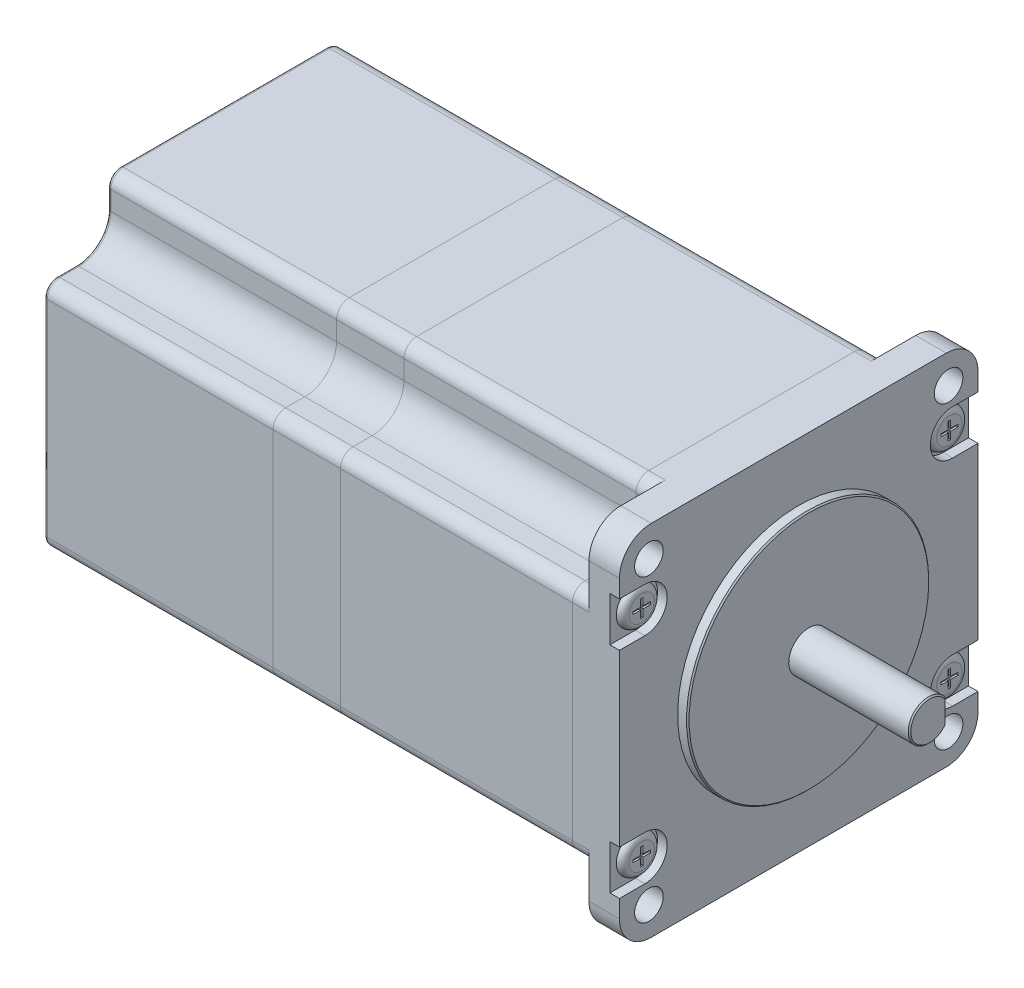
SolidWorks part; units mm, degrees
ref_plane "前视基准面" through (0, 0, 0) normal (0, 0, 1) x (1, 0, 0)
ref_plane "上视基准面" through (0, 0, 0) normal (0, 1, 0) x (1, 0, 0)
ref_plane "右视基准面" through (0, 0, 0) normal (1, 0, 0) x (0, 0, -1)
sketch "草图1" plane through (0, 0, 0) normal (1, 0, 0) x (0, 0, -1)
  line L1 (-23.2, -28.2) -> (23.2, -28.2)
  line L2 (-28.2, -23.2) -> (-28.2, 23.2)
  line L3 (-23.2, 28.2) -> (23.2, 28.2)
  line L4 (28.2, -23.2) -> (28.2, 23.2)
  line L5 (-28.2, -28.2) -> (28.2, 28.2) construction
  line L6 (-28.2, 28.2) -> (28.2, -28.2) construction
  arc A0 (-28.2, -23.2) -> (-23.2, -28.2) centre (-23.2, -23.2) ccw
  arc A1 (23.2, -28.2) -> (28.2, -23.2) centre (23.2, -23.2) ccw
  arc A2 (28.2, 23.2) -> (23.2, 28.2) centre (23.2, 23.2) ccw
  arc A3 (-28.2, 23.2) -> (-23.2, 28.2) centre (-23.2, 23.2) cw
  point P0 (0, 0)
  dimension "D1" = 5
extrude "凸台-拉伸1" add sketch "草图1" against normal blind 4.2
sketch "草图2" plane through (-4.2, 0, 0) normal (-1, 0, 0) x (0, 0, 1)
  line L0 (23.2, -18.2) -> (26.2, -18.2)
  line L1 (28.2, 23.2) -> (28.2, -23.2) construction
  line L2 (18.2, -23.2) -> (18.2, -26.2)
  line L3 (23.2, 18.2) -> (26.2, 18.2)
  line L4 (28.2, 16.2) -> (28.2, -16.2)
  line L5 (16.2, -28.2) -> (-16.2, -28.2)
  line L6 (-23.2, 28.2) -> (23.2, 28.2) construction
  line L7 (18.2, 26.2) -> (18.2, 23.2)
  line L8 (-28.2, -16.2) -> (-28.2, 16.2)
  line L9 (-18.2, 23.2) -> (-18.2, 26.2)
  line L10 (-16.2, 28.2) -> (16.2, 28.2)
  line L11 (-23.2, 18.2) -> (-26.2, 18.2)
  line L12 (-28.2, -23.2) -> (-28.2, 23.2) construction
  line L14 (-23.2, -18.2) -> (-26.2, -18.2)
  line L16 (-18.2, -23.2) -> (-18.2, -26.2)
  line L17 (23.2, -28.2) -> (-23.2, -28.2) construction
  arc A0 (18.2, 23.2) -> (23.2, 18.2) centre (23.2, 23.2) ccw
  arc A1 (-23.2, 18.2) -> (-18.2, 23.2) centre (-23.2, 23.2) ccw
  arc A2 (-18.2, -23.2) -> (-23.2, -18.2) centre (-23.2, -23.2) ccw
  arc A3 (23.2, -18.2) -> (18.2, -23.2) centre (23.2, -23.2) ccw
  arc A4 (18.2, -26.2) -> (16.2, -28.2) centre (16.2, -26.2) cw
  arc A5 (-16.2, -28.2) -> (-18.2, -26.2) centre (-16.2, -26.2) cw
  arc A6 (-26.2, -18.2) -> (-28.2, -16.2) centre (-26.2, -16.2) cw
  arc A7 (-28.2, 16.2) -> (-26.2, 18.2) centre (-26.2, 16.2) cw
  arc A8 (-18.2, 26.2) -> (-16.2, 28.2) centre (-16.2, 26.2) cw
  arc A9 (16.2, 28.2) -> (18.2, 26.2) centre (16.2, 26.2) cw
  arc A10 (26.2, 18.2) -> (28.2, 16.2) centre (26.2, 16.2) cw
  arc A11 (28.2, -16.2) -> (26.2, -18.2) centre (26.2, -16.2) cw
  point P7 (18.2, -28.2)
  point P38 (-18.2, -28.2)
  point P41 (-28.2, -18.2)
  point P44 (-28.2, 18.2)
  point P47 (-18.2, 28.2)
  point P50 (18.2, 28.2)
  point P53 (28.2, 18.2)
  point P56 (28.2, -18.2)
  dimension "D1" = 2
extrude "凸台-拉伸2" add sketch "草图2" along normal blind 3.2
sketch "草图3" plane through (-7.4, 0, 0) normal (-1, 0, 0) x (0, 0, 1)
  line L0 (28.2, -16.2) -> (28.2, 16.2)
  line L1 (23.2, 18.2) -> (26.2, 18.2)
  line L2 (-16.2, 28.2) -> (16.2, 28.2)
  line L3 (-18.2, 26.2) -> (-18.2, 23.2)
  line L4 (18.2, 26.2) -> (18.2, 23.2)
  line L5 (-23.2, 18.2) -> (-26.2, 18.2)
  line L7 (-28.2, 16.2) -> (-28.2, -16.2)
  line L9 (-26.2, -18.2) -> (-23.2, -18.2)
  line L11 (-18.2, -23.2) -> (-18.2, -26.2)
  line L13 (-16.2, -28.2) -> (16.2, -28.2)
  line L14 (18.2, -26.2) -> (18.2, -23.2)
  line L16 (23.2, -18.2) -> (26.2, -18.2)
  arc A0 (28.2, 16.2) -> (26.2, 18.2) centre (26.2, 16.2) ccw
  arc A1 (18.2, 26.2) -> (16.2, 28.2) centre (16.2, 26.2) ccw construction
  arc A2 (-26.2, 18.2) -> (-28.2, 16.2) centre (-26.2, 16.2) ccw
  arc A3 (-28.2, -16.2) -> (-26.2, -18.2) centre (-26.2, -16.2) ccw
  arc A4 (-18.2, -26.2) -> (-16.2, -28.2) centre (-16.2, -26.2) ccw
  arc A5 (16.2, -28.2) -> (18.2, -26.2) centre (16.2, -26.2) ccw
  arc A6 (26.2, -18.2) -> (28.2, -16.2) centre (26.2, -16.2) ccw
  arc A7 (23.2, -18.2) -> (18.2, -23.2) centre (23.2, -23.2) ccw
  arc A8 (-18.2, -23.2) -> (-23.2, -18.2) centre (-23.2, -23.2) ccw
  arc A9 (-23.2, 18.2) -> (-18.2, 23.2) centre (-23.2, 23.2) ccw
  arc A10 (18.2, 26.2) -> (16.2, 28.2) centre (16.2, 26.2) ccw
  arc A11 (18.2, 23.2) -> (23.2, 18.2) centre (23.2, 23.2) ccw
  arc A12 (-16.2, 28.2) -> (-18.2, 26.2) centre (-16.2, 26.2) ccw
extrude "凸台-拉伸3" add sketch "草图3" along normal blind 36.5 separate body
sketch "草图4" plane through (-43.9, 0, 0) normal (-1, 0, 0) x (0, 0, 1)
  line L0 (18.2, -23.2) -> (18.2, -26.2)
  line L3 (16.2, -28.2) -> (-16.2, -28.2)
  line L4 (-28.2, 16.2) -> (-28.2, -16.2)
  line L6 (19.6645, -19.6645) -> (-19.6645, 19.6645) construction
  line L7 (-23.2, -18.2) -> (-26.2, -18.2)
  line L8 (23.2, -18.2) -> (26.2, -18.2)
  line L9 (16.2, 28.2) -> (-16.2, 28.2)
  line L10 (23.2, 18.2) -> (26.2, 18.2)
  line L12 (18.2, 23.2) -> (18.2, 26.2)
  line L13 (-18.2, -23.2) -> (-18.2, -26.2)
  line L14 (-18.2, 23.2) -> (-18.2, 26.2)
  line L15 (19.6645, 19.6645) -> (-19.6645, -19.6645) construction
  line L16 (-23.2, 18.2) -> (-26.2, 18.2)
  line L17 (28.2, 16.2) -> (28.2, -16.2)
  arc A0 (23.2, -18.2) -> (18.2, -23.2) centre (23.2, -23.2) ccw
  arc A1 (28.2, 16.2) -> (26.2, 18.2) centre (26.2, 16.2) ccw
  arc A2 (-23.2, 18.2) -> (-18.2, 23.2) centre (-23.2, 23.2) ccw
  arc A3 (18.2, 23.2) -> (23.2, 18.2) centre (23.2, 23.2) ccw
  arc A4 (-18.2, -23.2) -> (-23.2, -18.2) centre (-23.2, -23.2) ccw
  arc A5 (18.2, 26.2) -> (16.2, 28.2) centre (16.2, 26.2) ccw
  arc A6 (-16.2, 28.2) -> (-18.2, 26.2) centre (-16.2, 26.2) ccw
  arc A7 (-26.2, 18.2) -> (-28.2, 16.2) centre (-26.2, 16.2) ccw
  arc A8 (-28.2, -16.2) -> (-26.2, -18.2) centre (-26.2, -16.2) ccw
  arc A9 (-18.2, -26.2) -> (-16.2, -28.2) centre (-16.2, -26.2) ccw
  arc A10 (18.2, -26.2) -> (16.2, -28.2) centre (16.2, -26.2) cw
  arc A11 (28.2, -16.2) -> (26.2, -18.2) centre (26.2, -16.2) cw
  point P0 (0, 0)
  dimension "D1" = 2
extrude "凸台-拉伸4" add sketch "草图4" along normal blind 10 separate body
sketch "草图5" plane through (0, 0, 0) normal (1, 0, 0) x (0, 0, -1)
  line L0 (24.2, -20.4) -> (28.2, -20.4)
  line L1 (28.2, -23.2) -> (28.2, 23.2) construction
  line L2 (28.2, -20.4) -> (28.2, -13.4)
  line L5 (28.2, -13.4) -> (24.2, -13.4)
  line L11 (24.2, 13.4) -> (28.2, 13.4)
  line L12 (28.2, 13.4) -> (28.2, 20.4)
  line L13 (28.2, 20.4) -> (24.2, 20.4)
  line L14 (-24.2, 20.4) -> (-28.2, 20.4)
  line L15 (-28.2, 23.2) -> (-28.2, -23.2) construction
  line L16 (-28.2, 20.4) -> (-28.2, 13.4)
  line L17 (-28.2, 13.4) -> (-24.2, 13.4)
  line L19 (-24.2, -13.4) -> (-28.2, -13.4)
  line L20 (-28.2, -13.4) -> (-28.2, -20.4)
  line L21 (-28.2, -20.4) -> (-24.2, -20.4)
  arc A0 (24.2, -13.4) -> (24.2, -20.4) centre (24.2, -16.9) ccw
  arc A1 (-24.2, -20.4) -> (-24.2, -13.4) centre (-24.2, -16.9) ccw
  arc A2 (-24.2, 13.4) -> (-24.2, 20.4) centre (-24.2, 16.9) ccw
  arc A3 (24.2, 20.4) -> (24.2, 13.4) centre (24.2, 16.9) ccw
extrude "切除-拉伸1" cut sketch "草图5" against normal blind 1.5
sketch "草图6" plane through (-1.5, 0, 0) normal (1, 0, 0) x (0, 0, -1)
  circle A0 centre (24.2, -16.9) radius 3
  circle A1 centre (-24.2, -16.9) radius 3
  circle A2 centre (-24.2, 16.9) radius 3
  circle A3 centre (24.2, 16.9) radius 3
extrude "凸台-拉伸5" add sketch "草图6" along normal blind 1
fillet "圆角1" radius 1 4 edges at (-0.5, 16.9, 21.2) (-0.5, 16.9, -27.2) (-0.5, -16.9, 21.2) (-0.5, -16.9, -27.2)
sketch "草图7" plane through (-0.5, 0, 0) normal (1, 0, 0) x (0, 0, -1)
  line L0 (24, -17.1) -> (24, -18.25)
  line L1 (24, -15.55) -> (24.4, -15.55)
  line L2 (24, -15.55) -> (24, -16.7)
  line L3 (24, -18.25) -> (24.4, -18.25)
  line L4 (24.4, -15.55) -> (24.4, -16.7)
  line L5 (24, 16.7) -> (24, 15.55)
  line L6 (24, 16.7) -> (22.85, 16.7)
  line L7 (25.55, -16.7) -> (24.4, -16.7)
  line L8 (25.55, -16.7) -> (25.55, -17.1)
  line L9 (25.55, -17.1) -> (24.4, -17.1)
  line L10 (22.85, -16.7) -> (22.85, -17.1)
  line L11 (24.4, 16.7) -> (24.4, 15.55)
  line L12 (24, 17.1) -> (22.85, 17.1)
  line L13 (-24.4, -15.55) -> (-24, -15.55)
  line L14 (-24.4, -15.55) -> (-24.4, -16.7)
  line L15 (-24.4, -18.25) -> (-24, -18.25)
  line L16 (-24, -15.55) -> (-24, -16.7)
  line L19 (-22.85, -16.7) -> (-24, -16.7)
  line L20 (-22.85, -16.7) -> (-22.85, -17.1)
  line L21 (-22.85, -17.1) -> (-24, -17.1)
  line L22 (-25.55, -16.7) -> (-25.55, -17.1)
  line L25 (-22.85, 17.1) -> (-24, 17.1)
  line L26 (-22.85, 17.1) -> (-22.85, 16.7)
  line L27 (-22.85, 16.7) -> (-24, 16.7)
  line L28 (-25.55, 17.1) -> (-25.55, 16.7)
  line L29 (-24.4, -17.1) -> (-24.4, -18.25)
  line L31 (-24.4, 18.25) -> (-24, 18.25)
  line L32 (-24.4, 18.25) -> (-24.4, 17.1)
  line L33 (-24.4, 15.55) -> (-24, 15.55)
  line L34 (-24, 18.25) -> (-24, 17.1)
  line L36 (-24.4, -17.1) -> (-25.55, -17.1)
  line L37 (24, 18.25) -> (24.4, 18.25)
  line L38 (24, 18.25) -> (24, 17.1)
  line L39 (24, 15.55) -> (24.4, 15.55)
  line L40 (24.4, 18.25) -> (24.4, 17.1)
  line L41 (-24.4, 16.7) -> (-24.4, 15.55)
  line L42 (-24, -17.1) -> (-24, -18.25)
  line L43 (25.55, 17.1) -> (24.4, 17.1)
  line L44 (25.55, 17.1) -> (25.55, 16.7)
  line L45 (25.55, 16.7) -> (24.4, 16.7)
  line L46 (22.85, 17.1) -> (22.85, 16.7)
  line L47 (-24.4, -16.7) -> (-25.55, -16.7)
  line L48 (-24.4, 16.7) -> (-25.55, 16.7)
  line L49 (-24, 16.7) -> (-24, 15.55)
  line L50 (-24.4, 17.1) -> (-25.55, 17.1)
  line L51 (24, -17.1) -> (22.85, -17.1)
  line L52 (24.4, -17.1) -> (24.4, -18.25)
  line L53 (24, -16.7) -> (22.85, -16.7)
  point P0 (24.2, -16.9)
  point P6 (24.2, -16.9)
  point P11 (-24.2, -16.9)
  point P17 (-24.2, -16.9)
  point P22 (-24.2, 16.9)
  point P28 (-24.2, 16.9)
  point P33 (24.2, 16.9)
  point P39 (24.2, 16.9)
extrude "切除-拉伸2" cut sketch "草图7" against normal blind 0.3
sketch "草图8" plane through (0, 0, 0) normal (1, 0, 0) x (0, 0, -1)
  circle A0 centre (23.57, -23.57) radius 2.25
  circle A1 centre (-23.57, -23.57) radius 2.25
  circle A2 centre (-23.57, 23.57) radius 2.25
  circle A3 centre (23.57, 23.57) radius 2.25
  point P0 (0, 0)
sketch "草图10" plane through (-4.2, 0, 0) normal (-1, 0, 0) x (0, 0, 1)
  line L0 (-18.2, -23.2) -> (-18.2, -26.2)
  line L1 (-16.2, -28.2) -> (-23.2, -28.2)
  line L3 (-28.2, -23.2) -> (-28.2, -16.2)
  line L5 (-26.2, -18.2) -> (-23.2, -18.2)
  line L6 (-18.2, 23.2) -> (-18.2, 26.2)
  line L8 (-16.2, 28.2) -> (-23.2, 28.2)
  line L10 (-28.2, 23.2) -> (-28.2, 16.2)
  line L12 (-26.2, 18.2) -> (-23.2, 18.2)
  line L13 (28.2, 16.2) -> (28.2, 23.2)
  line L15 (23.2, 28.2) -> (16.2, 28.2)
  line L17 (18.2, 26.2) -> (18.2, 23.2)
  line L19 (23.2, 18.2) -> (26.2, 18.2)
  line L20 (28.2, -23.2) -> (28.2, -16.2)
  line L22 (26.2, -18.2) -> (23.2, -18.2)
  line L24 (18.2, -23.2) -> (18.2, -26.2)
  line L26 (16.2, -28.2) -> (23.2, -28.2)
  arc A0 (-18.2, -23.2) -> (-23.2, -18.2) centre (-23.2, -23.2) ccw
  arc A1 (-18.2, -26.2) -> (-16.2, -28.2) centre (-16.2, -26.2) ccw
  arc A2 (-28.2, -16.2) -> (-26.2, -18.2) centre (-26.2, -16.2) ccw
  arc A3 (-23.2, 28.2) -> (-28.2, 23.2) centre (-23.2, 23.2) ccw
  arc A4 (-16.2, 28.2) -> (-18.2, 26.2) centre (-16.2, 26.2) ccw
  arc A5 (-26.2, 18.2) -> (-28.2, 16.2) centre (-26.2, 16.2) ccw
  arc A6 (28.2, 23.2) -> (23.2, 28.2) centre (23.2, 23.2) ccw
  arc A7 (18.2, 26.2) -> (16.2, 28.2) centre (16.2, 26.2) ccw
  arc A8 (28.2, 16.2) -> (26.2, 18.2) centre (26.2, 16.2) ccw
  arc A9 (23.2, -28.2) -> (28.2, -23.2) centre (23.2, -23.2) ccw
  arc A10 (26.2, -18.2) -> (28.2, -16.2) centre (26.2, -16.2) ccw
  arc A11 (16.2, -28.2) -> (18.2, -26.2) centre (16.2, -26.2) ccw
  arc A12 (23.2, -18.2) -> (18.2, -23.2) centre (23.2, -23.2) ccw
  arc A13 (18.2, 23.2) -> (23.2, 18.2) centre (23.2, 23.2) ccw
  arc A14 (-28.2, -23.2) -> (-23.2, -28.2) centre (-23.2, -23.2) ccw
  arc A15 (-23.2, 18.2) -> (-18.2, 23.2) centre (-23.2, 23.2) ccw
extrude "凸台-拉伸6" add sketch "草图10" along normal blind 0.6
extrude "切除-拉伸3" cut sketch "草图8" against normal blind 4.8
sketch "草图12" plane through (-53.9, 0, 0) normal (-1, 0, 0) x (0, 0, 1)
  line L0 (-16.2, -28.2) -> (16.2, -28.2)
  line L2 (18.2, -26.2) -> (18.2, -23.2)
  line L4 (23.2, -18.2) -> (26.2, -18.2)
  line L6 (28.2, -16.2) -> (28.2, 16.2)
  line L8 (26.2, 18.2) -> (23.2, 18.2)
  line L10 (18.2, 23.2) -> (18.2, 26.2)
  line L12 (16.2, 28.2) -> (-16.2, 28.2)
  line L14 (-18.2, 26.2) -> (-18.2, 23.2)
  line L16 (-23.2, 18.2) -> (-26.2, 18.2)
  line L18 (-28.2, 16.2) -> (-28.2, -16.2)
  line L20 (-26.2, -18.2) -> (-23.2, -18.2)
  line L22 (-18.2, -23.2) -> (-18.2, -26.2)
  arc A0 (-28.2, -16.2) -> (-26.2, -18.2) centre (-26.2, -16.2) ccw
  arc A1 (-18.2, -26.2) -> (-16.2, -28.2) centre (-16.2, -26.2) ccw
  arc A2 (-26.2, 18.2) -> (-28.2, 16.2) centre (-26.2, 16.2) ccw
  arc A3 (-16.2, 28.2) -> (-18.2, 26.2) centre (-16.2, 26.2) ccw
  arc A4 (18.2, 26.2) -> (16.2, 28.2) centre (16.2, 26.2) ccw
  arc A5 (28.2, 16.2) -> (26.2, 18.2) centre (26.2, 16.2) ccw
  arc A6 (26.2, -18.2) -> (28.2, -16.2) centre (26.2, -16.2) ccw
  arc A7 (16.2, -28.2) -> (18.2, -26.2) centre (16.2, -26.2) ccw
  arc A8 (-18.2, -23.2) -> (-23.2, -18.2) centre (-23.2, -23.2) ccw
  arc A9 (-23.2, 18.2) -> (-18.2, 23.2) centre (-23.2, 23.2) ccw
  arc A10 (18.2, 23.2) -> (23.2, 18.2) centre (23.2, 23.2) ccw
  arc A11 (23.2, -18.2) -> (18.2, -23.2) centre (23.2, -23.2) ccw
extrude "凸台-拉伸7" add sketch "草图12" along normal blind 0.6
sketch "草图14" plane through (0, 0, 0) normal (1, 0, 0) x (0, 0, -1)
  circle A0 centre (0, 0) radius 19.05
extrude "凸台-拉伸8" add sketch "草图14" along normal blind 1.6
chamfer "倒角1" distance 0.2 angle 45 1 edges at (1.6, 0, -19.05)
sketch "草图15" plane through (1.6, 0, 0) normal (1, 0, 0) x (0, 0, -1)
  circle A0 centre (0, 0) radius 3.175
extrude "凸台-拉伸9" add sketch "草图15" along normal blind 19
sketch "草图16" plane through (20.6, 0, 0) normal (1, 0, 0) x (0, 0, -1)
  line L2 (2.625, -1.7861) -> (2.625, 1.7861)
  circle A0 centre (0, 0) radius 3.175 construction
  arc A1 (2.625, -1.7861) -> (2.625, 1.7861) centre (0, 0) ccw
extrude "切除-拉伸4" cut sketch "草图16" against normal blind 15
chamfer "倒角2" distance 0.2 angle 45 2 edges at (20.6, 0, 3.175) (20.6, 0, -2.625)
sketch "草图20" plane through (-54.5, 0, 0) normal (-1, 0, 0) x (0, 0, 1)
  circle A0 centre (0, 0) radius 3.675
extrude "切除-拉伸5" cut sketch "草图20" against normal blind 3
sketch "草图21" plane through (-51.5, 0, 0) normal (-1, 0, 0) x (0, 0, 1)
  circle A0 centre (0, 0) radius 3.175
extrude "凸台-拉伸10" add sketch "草图21" along normal blind 3
chamfer "倒角3" distance 0.3 angle 45 1 edges at (-54.5, 0, 3.175)
sketch "草图22" plane through (-54.5, 0, 0) normal (-1, 0, 0) x (0, 0, 1)
  line L1 (-16.2, -28.2) -> (16.2, -28.2)
  line L3 (-28.2, -16.2) -> (-28.2, 16.2)
  line L4 (28.2, -16.2) -> (28.2, 16.2)
  line L7 (-23.2, 18.2) -> (-26.2, 18.2)
  line L13 (-26.2, -18.2) -> (-23.2, -18.2)
  line L15 (-18.2, -23.2) -> (-18.2, -26.2)
  line L21 (18.2, -26.2) -> (18.2, -23.2)
  line L23 (23.2, -18.2) -> (26.2, -18.2)
  line L29 (26.2, 18.2) -> (23.2, 18.2)
  line L31 (18.2, 23.2) -> (18.2, 26.2)
  line L37 (-18.2, 26.2) -> (-18.2, 23.2)
  line L38 (-16.2, 28.2) -> (16.2, 28.2)
  arc A0 (-18.2, -23.2) -> (-23.2, -18.2) centre (-23.2, -23.2) ccw
  arc A1 (23.2, -18.2) -> (18.2, -23.2) centre (23.2, -23.2) ccw
  arc A3 (-16.2, 28.2) -> (-18.2, 26.2) centre (-16.2, 26.2) ccw
  arc A4 (-26.2, 18.2) -> (-28.2, 16.2) centre (-26.2, 16.2) ccw
  arc A5 (18.2, 23.2) -> (23.2, 18.2) centre (23.2, 23.2) ccw
  arc A6 (18.2, 26.2) -> (16.2, 28.2) centre (16.2, 26.2) ccw
  arc A7 (28.2, 16.2) -> (26.2, 18.2) centre (26.2, 16.2) ccw
  arc A8 (26.2, -18.2) -> (28.2, -16.2) centre (26.2, -16.2) ccw
  arc A9 (16.2, -28.2) -> (18.2, -26.2) centre (16.2, -26.2) ccw
  arc A10 (-18.2, -26.2) -> (-16.2, -28.2) centre (-16.2, -26.2) ccw
  arc A11 (-28.2, -16.2) -> (-26.2, -18.2) centre (-26.2, -16.2) ccw
  arc A12 (-23.2, 18.2) -> (-18.2, 23.2) centre (-23.2, 23.2) ccw
  point P0 (0, 0)
extrude "凸台-拉伸11" add sketch "草图22" along normal blind 36 separate body
fillet "圆角2" radius 0.5 24 edges at (-90.5, 0, 28.2) (-90.5, -17.6142, 27.6142) (-90.5, -18.2, 24.7) (-90.5, -19.6645, 19.6645) (-90.5, -24.7, 18.2) (-90.5, -27.6142, 17.6142) (-90.5, -28.2, 0) (-90.5, -27.6142, -17.6142) (-90.5, -24.7, -18.2) (-90.5, -19.6645, -19.6645) (-90.5, -18.2, -24.7) (-90.5, -17.6142, -27.6142) (-90.5, 0, -28.2) (-90.5, 17.6142, -27.6142) (-90.5, 18.2, -24.7) (-90.5, 19.6645, -19.6645) (-90.5, 24.7, -18.2) (-90.5, 27.6142, -17.6142) (-90.5, 28.2, 0) (-90.5, 27.6142, 17.6142) (-90.5, 24.7, 18.2) (-90.5, 19.6645, 19.6645) (-90.5, 18.2, 24.7) (-90.5, 17.6142, 27.6142)
